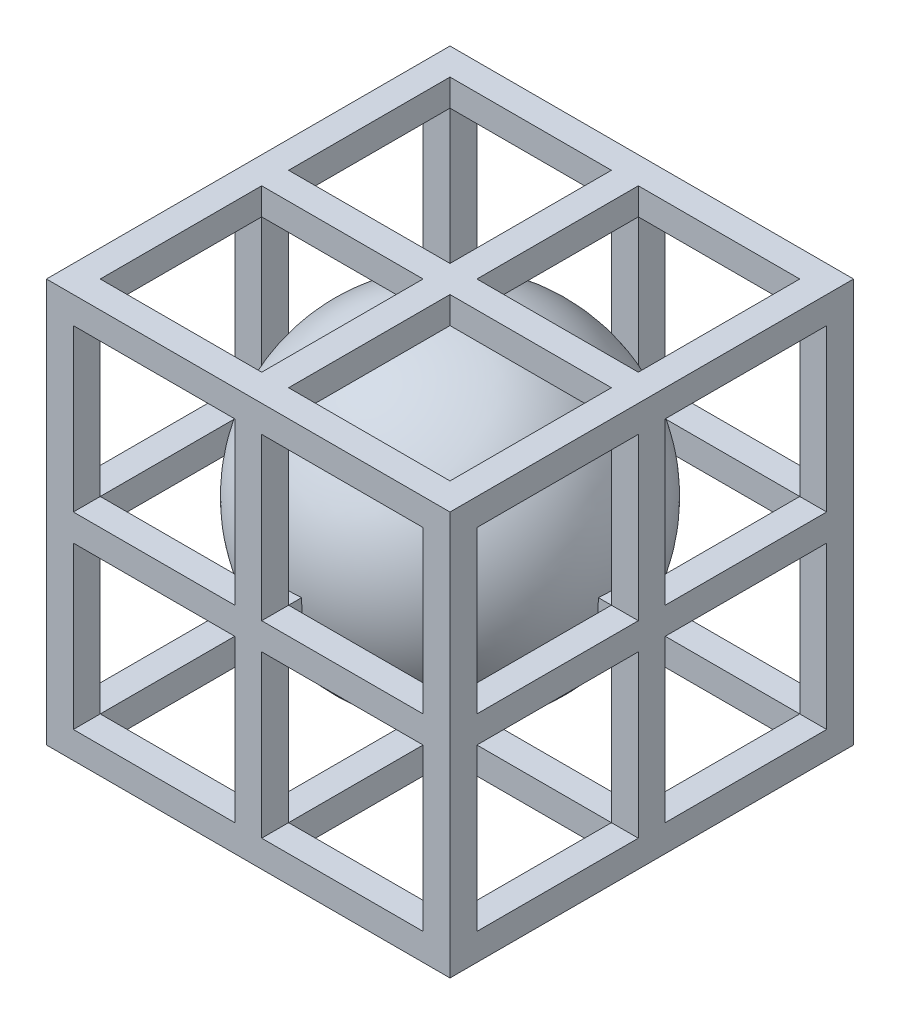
SolidWorks part; units mm, degrees
ref_plane "Alzado" through (0, 0, 0) normal (0, 0, 1) x (1, 0, 0)
ref_plane "Planta" through (0, 0, 0) normal (0, 1, 0) x (1, 0, 0)
ref_plane "Vista lateral" through (0, 0, 0) normal (1, 0, 0) x (0, 0, -1)
sketch "Croquis1" plane through (0, 0, 0) normal (0, 1, 0) x (1, 0, 0)
  line L0 (11.228, 14.2897) -> (-0.772, 14.2897)
  line L1 (-2.772, 28.2897) -> (27.228, 28.2897)
  line L2 (-2.772, 28.2897) -> (-2.772, -1.7103)
  line L3 (-2.772, -1.7103) -> (27.228, -1.7103)
  line L4 (27.228, 28.2897) -> (27.228, -1.7103)
  line L5 (-0.772, 26.2897) -> (11.228, 26.2897)
  line L6 (-0.772, 26.2897) -> (-0.772, 14.2897)
  line L7 (-0.772, 0.2897) -> (11.228, 0.2897)
  line L8 (25.228, 26.2897) -> (25.228, 14.2897)
  line L9 (11.228, 12.2897) -> (11.228, 0.2897)
  line L10 (25.228, 14.2897) -> (13.228, 14.2897)
  line L11 (11.228, 26.2897) -> (11.228, 14.2897)
  line L12 (25.228, 12.2897) -> (13.228, 12.2897)
  line L13 (13.228, 26.2897) -> (13.228, 14.2897)
  line L14 (13.228, 12.2897) -> (13.228, 0.2897)
  line L15 (11.228, 12.2897) -> (-0.772, 12.2897)
  line L16 (25.228, 12.2897) -> (25.228, 0.2897)
  line L17 (13.228, 0.2897) -> (25.228, 0.2897)
  line L18 (-0.772, 12.2897) -> (-0.772, 0.2897)
  line L19 (13.228, 26.2897) -> (25.228, 26.2897)
  dimension "D1" = 30
  dimension "D2" = 30
  dimension "D3" = 26
  dimension "D4" = 26
  dimension "D5" = 2
  dimension "D6" = 2
extrude "Saliente-Extruir1" add sketch "Croquis1" along normal blind 30
sketch "Croquis2" plane through (0, 0, 1.7103) normal (0, 0, 1) x (1, 0, 0)
  line L1 (-0.772, 28) -> (11.228, 28)
  line L2 (-0.772, 28) -> (-0.772, 16)
  line L3 (-0.772, 16) -> (11.228, 16)
  line L4 (11.228, 28) -> (11.228, 16)
  line L9 (13.228, 28) -> (25.228, 28)
  line L10 (13.228, 28) -> (13.228, 16)
  line L11 (13.228, 16) -> (25.228, 16)
  line L12 (25.228, 28) -> (25.228, 16)
  line L13 (-0.772, 14) -> (11.228, 14)
  line L14 (-0.772, 14) -> (-0.772, 2)
  line L15 (-0.772, 2) -> (11.228, 2)
  line L16 (11.228, 14) -> (11.228, 2)
  line L17 (13.228, 14) -> (25.228, 14)
  line L18 (13.228, 14) -> (13.228, 2)
  line L19 (13.228, 2) -> (25.228, 2)
  line L20 (25.228, 14) -> (25.228, 2)
  dimension "D1" = 12
  dimension "D2" = 12
  dimension "D3" = 12
  dimension "D4" = 12
  dimension "D5" = 12
  dimension "D6" = 12
  dimension "D7" = 12
  dimension "D8" = 12
extrude "Cortar-Extruir1" cut sketch "Croquis2" against normal blind 50
sketch "Croquis3" plane through (27.228, 0, 0) normal (1, 0, 0) x (0, 0, -1)
  line L0 (-1.7103, 30) -> (-1.7103, 0) construction
  line L1 (0.2897, 28) -> (12.2897, 28)
  line L2 (0.2897, 28) -> (0.2897, 16)
  line L3 (0.2897, 16) -> (12.2897, 16)
  line L4 (12.2897, 28) -> (12.2897, 16)
  line L17 (-1.7103, 30) -> (28.2897, 30) construction
  line L18 (14.2897, 28) -> (14.2897, 16)
  line L19 (14.2897, 28) -> (26.2897, 28)
  line L20 (26.2897, 28) -> (26.2897, 16)
  line L21 (14.2897, 16) -> (26.2897, 16)
  line L22 (14.2897, 14) -> (14.2897, 2)
  line L23 (14.2897, 14) -> (26.2897, 14)
  line L24 (26.2897, 14) -> (26.2897, 2)
  line L25 (14.2897, 2) -> (26.2897, 2)
  line L26 (0.2897, 14) -> (0.2897, 2)
  line L27 (0.2897, 14) -> (12.2897, 14)
  line L28 (12.2897, 14) -> (12.2897, 2)
  line L29 (0.2897, 2) -> (12.2897, 2)
  dimension "D1" = 12
  dimension "D2" = 12
  dimension "D3" = 2
  dimension "D4" = 2
extrude "Cortar-Extruir2" cut sketch "Croquis3" against normal blind 50
sketch "Croquis4" plane through (0, 16, 0) normal (0, 1, 0) x (1, 0, 0)
  line L0 (11.228, 6.2897) -> (13.228, 20.2897) construction
  line L1 (11.228, 12.2897) -> (11.228, 0.2897) construction
  line L2 (13.228, 14.2897) -> (13.228, 26.2897) construction
  line L3 (10.5209, 1.3399) -> (10.9451, 4.3098)
  line L4 (13.5108, 22.2696) -> (13.9351, 25.2394)
  arc A0 (10.9451, 4.3098) -> (13.5108, 22.2696) centre (12.228, 13.2897) ccw
  arc A1 (10.5209, 1.3399) -> (13.9351, 25.2394) centre (12.228, 13.2897) ccw
  dimension "D1" = 3
revolve "Revolución1" add sketch "Croquis4" angle 360 about L4
